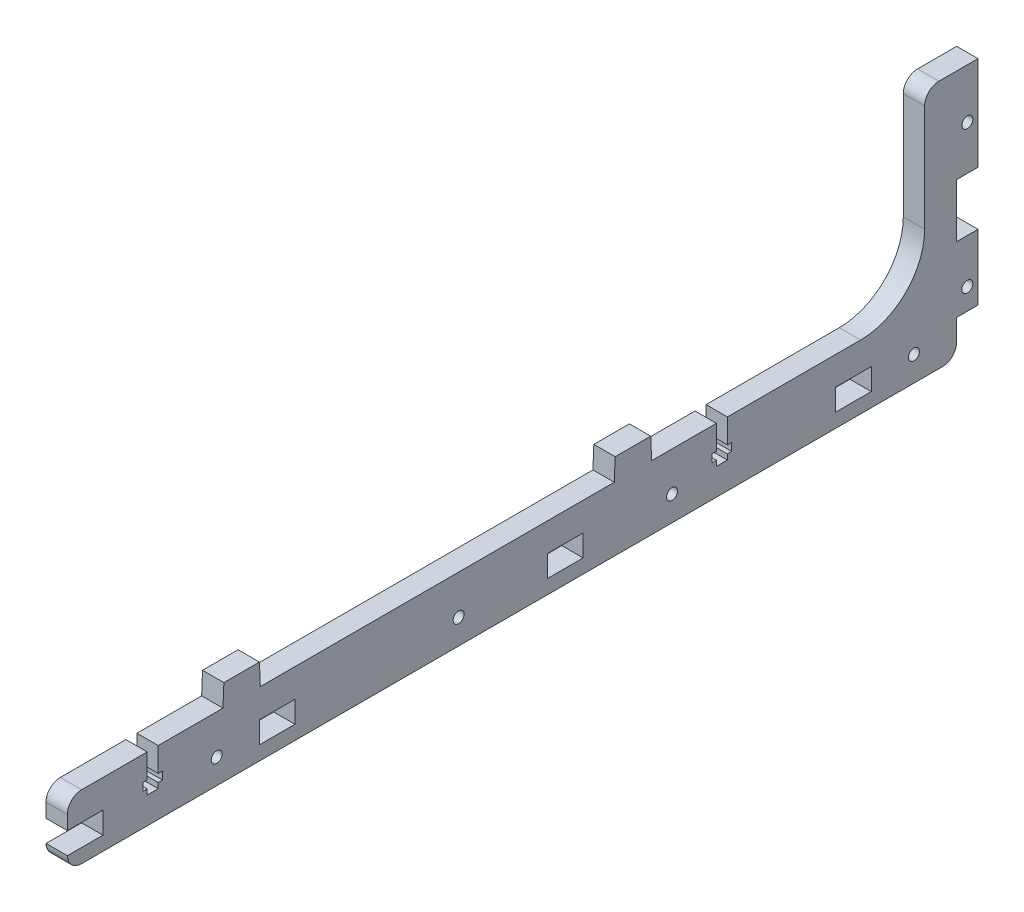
SolidWorks part; units mm, degrees
ref_plane "Спереди" through (0, 0, 0) normal (0, 0, 1) x (1, 0, 0)
ref_plane "Сверху" through (0, 0, 0) normal (0, 1, 0) x (1, 0, 0)
ref_plane "Справа" through (0, 0, 0) normal (1, 0, 0) x (0, 0, -1)
sketch "Эскиз1" plane through (0, 0, 0) normal (1, 0, 0) x (0, 0, -1)
  line L0 (0, 139.2616) -> (0, 0) construction
  line L1 (0, 0) -> (-258.4912, 0) construction
  line L2 (-6, 0) -> (-256, 0)
  line L3 (-256, 0) -> (-256, 3.95)
  line L4 (-256, 18) -> (-212.25, 18)
  line L5 (-15, 18) -> (-15, 70)
  line L6 (-15, 70) -> (0, 70)
  line L7 (0, 70) -> (0, 10)
  line L8 (-256, 3.95) -> (-246, 3.95)
  line L9 (-246, 3.95) -> (-246, 10.05)
  line L10 (-246, 10.05) -> (-256, 10.05)
  line L11 (-256, 10.05) -> (-256, 18)
  line L12 (-116, -0.05) -> (-116, 41.7455) construction
  line L13 (-121, 10.05) -> (-111, 10.05)
  line L14 (-121, 10.05) -> (-121, 3.95)
  line L15 (-121, 3.95) -> (-111, 3.95)
  line L16 (-111, 10.05) -> (-111, 3.95)
  line L17 (0, 10) -> (-6, 10)
  line L18 (-40, 10.05) -> (-30, 10.05)
  line L19 (-40, 10.05) -> (-40, 3.95)
  line L20 (-40, 3.95) -> (-30, 3.95)
  line L21 (-202, 10.05) -> (-202, 3.95)
  line L22 (-192, 3.95) -> (-202, 3.95)
  line L23 (-192, 10.05) -> (-192, 3.95)
  line L24 (-192, 10.05) -> (-202, 10.05)
  line L26 (-30, 10.05) -> (-30, 3.95)
  line L27 (-6, 10) -> (-6, 0)
  line L28 (-246, 7) -> (-262.23, 7) construction
  line L29 (-212.25, 18) -> (-212, 24.1)
  line L30 (-212, 24.1) -> (-202, 24.1)
  line L31 (-202, 24.1) -> (-201.75, 18)
  line L32 (-201.75, 18) -> (-102.25, 18)
  line L33 (-102.25, 18) -> (-102, 24.1)
  line L34 (-102, 24.1) -> (-92, 24.1)
  line L35 (-92, 24.1) -> (-91.75, 18)
  line L36 (-91.75, 18) -> (-15, 18)
  point P23 (-116, 3.95)
  dimension "D1" = 256
  dimension "D2" = 70
  dimension "D3" = 7
  dimension "D4" = 6.1
  dimension "D5" = 10
  dimension "D6" = 6.1
  dimension "D7" = 116
  dimension "D8" = 10
  dimension "D9" = 18
  dimension "D10" = 15
  dimension "D11" = 81
  dimension "D12" = 10
  dimension "D13" = 6
  dimension "D14" = 10
  dimension "D15" = 10.5
  dimension "D16" = 6.1
  dimension "D17" = 92
  dimension "D18" = 100
  dimension "D19" = 10.5
extrude "Бобышка-Вытянуть1" add sketch "Эскиз1" along normal blind 6
fillet "Скругление1" radius 4 4 edges at (3, 70, 15) (3, 18, 256) (3, 0, 256) (3, 0, 6)
fillet "Скругление2" radius 18 1 edges at (3, 18, 15)
sketch "Эскиз2" plane through (6, 0, 0) normal (1, 0, 0) x (0, 0, -1)
  line L0 (-246, 7) -> (0, 7) construction
  line L1 (-246, 10.05) -> (-246, 3.95) construction
  line L2 (0, 10) -> (0, 70) construction
  line L3 (-3, 0) -> (-3, 70) construction
  line L4 (-252.0003, 0) -> (-10, 0) construction
  line L5 (0, 70) -> (-11, 70) construction
  line L6 (0, 36) -> (-38.9899, 36) construction
  line L7 (-30, 3.95) -> (-30, 10.05) construction
  line L9 (-116, 3.95) -> (-116, 24.9794) construction
  line L10 (-121, 3.95) -> (-111, 3.95) construction
  circle A0 centre (-3, 56) radius 1.55
  circle A1 centre (-3, 16) radius 1.55
  circle A2 centre (-214, 7) radius 1.55
  circle A3 centre (-146, 7) radius 1.55
  circle A4 centre (-86, 7) radius 1.55
  circle A5 centre (-18, 7) radius 1.55
  dimension "D2" = 40
  dimension "D3" = 3.1
  dimension "D4" = 12
  dimension "D5" = 60
  dimension "D6" = 30
  dimension "D1" = 3
  dimension "D8" = 34
extrude "Вырез-Вытянуть1" cut sketch "Эскиз2" against normal through all
sketch "Эскиз3" plane through (6, 0, 0) normal (1, 0, 0) x (0, 0, -1)
  line L0 (0, 36) -> (-29.5448, 36) construction
  line L1 (0, 10) -> (0, 70) construction
  line L2 (0, 70) -> (-11, 70) construction
  line L3 (0, 43.55) -> (-6.1, 43.55)
  line L4 (0, 43.55) -> (0, 28.45)
  line L5 (0, 28.45) -> (-6.1, 28.45)
  line L6 (-6.1, 43.55) -> (-6.1, 28.45)
  point P8 (-6.1, 36)
  dimension "D1" = 15.1
  dimension "D2" = 6.1
  dimension "D3" = 34
extrude "Вырез-Вытянуть2" cut sketch "Эскиз3" against normal through all
sketch "Эскиз4" plane through (6, 0, 0) normal (1, 0, 0) x (0, 0, -1)
  line L0 (-232, 18) -> (-232, 7.3828) construction
  line L1 (-212.25, 18) -> (-252, 18) construction
  line L2 (-256, 14) -> (-256, 10.05) construction
  line L3 (-233.55, 18) -> (-233.55, 11.2)
  line L4 (-233.55, 11.2) -> (-234.75, 11.2)
  line L5 (-234.75, 11.2) -> (-234.75, 9)
  line L6 (-234.75, 9) -> (-233.55, 9)
  line L7 (-233.55, 9) -> (-233.55, 7.5)
  line L8 (-233.55, 7.5) -> (-230.45, 7.5)
  line L9 (-233.55, 18) -> (-230.45, 18)
  line L10 (-230.45, 9) -> (-230.45, 7.5)
  line L11 (-229.25, 9) -> (-230.45, 9)
  line L12 (-229.25, 11.2) -> (-229.25, 9)
  line L13 (-230.45, 11.2) -> (-229.25, 11.2)
  line L14 (-230.45, 18) -> (-230.45, 11.2)
  line L15 (-73.55, 7.5) -> (-70.45, 7.5)
  line L16 (-70.45, 9) -> (-70.45, 7.5)
  line L17 (-69.25, 9) -> (-70.45, 9)
  line L18 (-69.25, 11.2) -> (-69.25, 9)
  line L19 (-70.45, 11.2) -> (-69.25, 11.2)
  line L20 (-70.45, 18) -> (-70.45, 11.2)
  line L21 (-73.55, 18) -> (-70.45, 18)
  line L22 (-73.55, 18) -> (-73.55, 11.2)
  line L23 (-73.55, 11.2) -> (-74.75, 11.2)
  line L24 (-74.75, 11.2) -> (-74.75, 9)
  line L25 (-74.75, 9) -> (-73.55, 9)
  line L26 (-73.55, 9) -> (-73.55, 7.5)
  line L27 (-33, 18) -> (-91.75, 18) construction
  point P15 (-232, 7.5)
  dimension "D1" = 24
  dimension "D2" = 3.1
  dimension "D3" = 5.5
  dimension "D4" = 1.5
  dimension "D5" = 2.2
  dimension "D6" = 10.5
  dimension "D8" = 160
  dimension "D7" = 2
extrude "Вырез-Вытянуть3" cut sketch "Эскиз4" against normal through all
